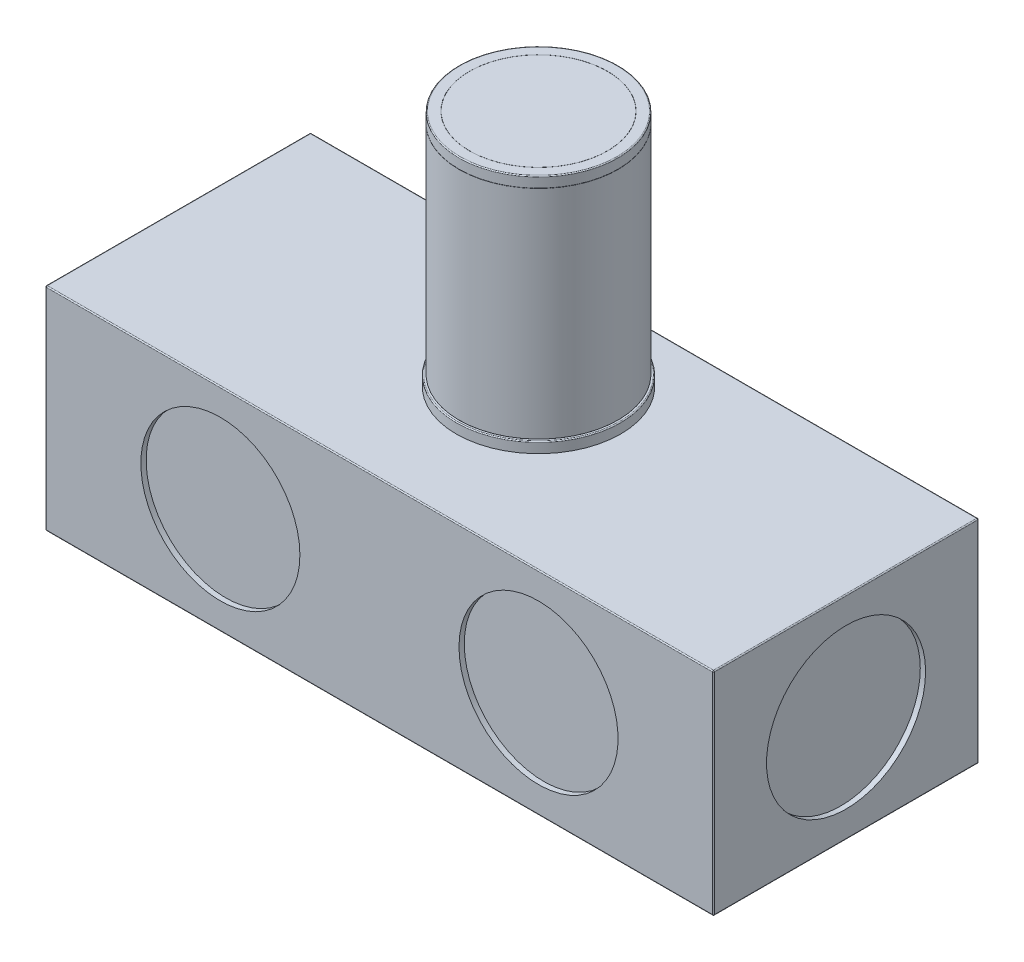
SolidWorks part; units mm, degrees
ref_plane "Front Plane" through (0, 0, 0) normal (0, 0, 1) x (1, 0, 0)
ref_plane "Top Plane" through (0, 0, 0) normal (0, 1, 0) x (1, 0, 0)
ref_plane "Right Plane" through (0, 0, 0) normal (1, 0, 0) x (0, 0, -1)
sketch "Sketch1" plane through (0, 0, 0) normal (0, 0, 1) x (1, 0, 0)
  line L1 (-31.5, 0) -> (31.5, 0)
  line L2 (-31.5, 0) -> (-31.5, 20)
  line L3 (-31.5, 20) -> (31.5, 20)
  line L4 (31.5, 0) -> (31.5, 20)
  dimension "D1" = 20
  dimension "D2" = 63
  dimension "D3" = 31.5
extrude "Boss-Extrude1" add sketch "Sketch1" along normal blind 25
sketch "Sketch2" plane through (31.5, 0, 0) normal (1, 0, 0) x (0, 0, -1)
  line L0 (-12.5, 20) -> (-12.5, 0) construction
  line L1 (-25, 20) -> (0, 20) construction
  line L2 (-25, 0) -> (0, 0) construction
  line L3 (0, 10) -> (-25, 10) construction
  line L4 (0, 0) -> (0, 20) construction
  line L5 (-25, 0) -> (-25, 20) construction
  circle A0 centre (-12.5, 10) radius 7.5
  dimension "D1" = 15
extrude "Cut-Extrude1" cut sketch "Sketch2" against normal blind 0.5
sketch "Sketch3" plane through (-31.5, 0, 0) normal (-1, 0, 0) x (0, 0, 1)
  line L0 (12.5, 20) -> (12.5, 0) construction
  line L1 (25, 20) -> (0, 20) construction
  line L2 (25, 0) -> (0, 0) construction
  line L3 (25, 10) -> (0, 10) construction
  line L4 (25, 20) -> (25, 0) construction
  line L5 (0, 20) -> (0, 0) construction
  circle A0 centre (12.5, 10) radius 7.5
  dimension "D1" = 15
extrude "Cut-Extrude2" cut sketch "Sketch3" against normal blind 0.5
sketch "Sketch4" plane through (0, 0, 0) normal (1, 0, 0) x (0, 0, -1)
  line L0 (-10, 42.5) -> (-10, -7.5) construction
  line L1 (-17.5, 21.019) -> (-17.5, 41.481)
  line L2 (-25, 0) -> (0, 0) construction
  line L3 (-17.41, 42.5) -> (-16.51, 42.5)
  line L4 (0, 0) -> (0, 20) construction
  line L5 (-17.75, -0.81) -> (-17.75, 20.91)
  line L6 (-17.66, -0.9) -> (-14.75, -0.9)
  line L7 (-25, 20) -> (0, 20) construction
  line L8 (-17.66, 21) -> (-17.4, 21)
  line L11 (-17.4, 21.01) -> (-17.491, 21.01)
  line L12 (-17.491, 41.49) -> (-17.49, 41.49)
  line L13 (-17.49, 41.49) -> (-17.49, 41.5)
  line L14 (-17.49, 41.5) -> (-17.491, 41.5)
  line L15 (-17.5, 41.509) -> (-17.5, 42.41)
  line L16 (-10, 42.5) -> (-10, -0.9)
  line L17 (-14.75, -0.9) -> (-14.75, -1)
  line L18 (-14.75, -1) -> (-10, -1)
  line L19 (-10, -0.9) -> (-10, -1)
  line L20 (-16.51, 42.5) -> (-16.51, 42.4)
  line L21 (-16.51, 42.4) -> (-16.5, 42.4)
  line L22 (-16.5, 42.4) -> (-16.5, 42.5)
  line L23 (-16.5, 42.5) -> (-10, 42.5)
  line L24 (-17.4, 21) -> (-17.4, 21.01)
  arc A0 (-17.75, 20.91) -> (-17.66, 21) centre (-17.66, 20.91) cw
  arc A1 (-17.75, -0.81) -> (-17.66, -0.9) centre (-17.66, -0.81) ccw
  arc A2 (-17.5, 42.41) -> (-17.41, 42.5) centre (-17.41, 42.41) cw
  arc A3 (-17.491, 41.49) -> (-17.5, 41.481) centre (-17.491, 41.481) ccw
  arc A4 (-17.491, 41.5) -> (-17.5, 41.509) centre (-17.491, 41.509) cw
  arc A5 (-17.491, 21.01) -> (-17.5, 21.019) centre (-17.491, 21.019) cw
  point P22 (-17.75, 21)
  point P25 (-17.75, -0.9)
  point P28 (-17.5, 42.5)
  point P34 (-17.5, 41.49)
  point P37 (-17.5, 41.5)
  dimension "D13" = 0.09
  dimension "D17" = 0.009
  dimension "D21" = 0.009
  dimension "D1" = 10
  dimension "D2" = 50
  dimension "D3" = 7.5
  dimension "D4" = 7.75
  dimension "D5" = 1
  dimension "D6" = 0.9
  dimension "D7" = 7.5
  dimension "D8" = 0.01
  dimension "D9" = 0.01
  dimension "D10" = 0.01
  dimension "D11" = 0.1
  dimension "D12" = 1
  dimension "D14" = 3
  dimension "D15" = 0.1
  dimension "D16" = 7.75
  dimension "D18" = 0.01
  dimension "D19" = 0.1
  dimension "D20" = 1
revolve "Revolve2" add sketch "Sketch4" angle 360 about L0
sketch "Sketch6" plane through (0, -1, 0) normal (0, -1, 0) x (1, 0, 0)
  line L1 (0, 17.7942) -> (-6.75, 13.8971)
  line L2 (-6.75, 13.8971) -> (-6.75, 6.1029)
  line L3 (-6.75, 6.1029) -> (0, 2.2058)
  line L4 (0, 2.2058) -> (6.75, 6.1029)
  line L5 (6.75, 6.1029) -> (6.75, 13.8971)
  line L6 (6.75, 13.8971) -> (0, 17.7942)
  circle A0 centre (0, 10) radius 6.75 construction
  dimension "D1" = 13.5
extrude "Boss-Extrude3" add sketch "Sketch6" along normal blind 6.5
sketch "Sketch7" plane through (0, 0, 0) normal (1, 0, 0) x (0, 0, -1)
  line L0 (-18.0242, -6.72) -> (-16.6384, -7.62)
  line L1 (-13.8971, -7.5) -> (-17.7942, -7.5) construction
  line L2 (-18.0242, -6.72) -> (-18.0242, -7.62)
  line L3 (-18.0242, -7.62) -> (-16.6384, -7.62)
  line L4 (-10, -1) -> (-10, -7.5) construction
  line L5 (-6.1029, -1) -> (-13.8971, -1) construction
  line L6 (-6.1029, -7.5) -> (-13.8971, -7.5) construction
  line L7 (-17.7942, -4.25) -> (-2.2058, -4.25) construction
  line L8 (-17.7942, -7.5) -> (-17.7942, -1) construction
  line L9 (-2.2058, -7.5) -> (-2.2058, -1) construction
  line L10 (-13.8971, -1) -> (-17.7942, -1) construction
  line L11 (-18.0242, -1.78) -> (-18.0242, -0.9241)
  line L12 (-18.0242, -1.78) -> (-16.7078, -0.9241)
  line L13 (-18.0242, -0.9241) -> (-16.7078, -0.9241)
  dimension "D1" = 33
  dimension "D2" = 0.9
  dimension "D3" = 3.25
  dimension "D4" = 0.12
  dimension "D5" = 0.0759
  dimension "D6" = 0.23
revolve "Cut-Revolve1" cut sketch "Sketch7" angle 360 about L4
fillet "Fillet2" radius 0.1 12 edges at (0, 20, 25) (31.5, 10, 25) (0, 0, 25) (-31.5, 10, 25) (0, 0, 0) (31.5, 10, 0) (0, 20, 0) (-31.5, 10, 0) (-31.5, 0, 12.5) (-31.5, 20, 12.5) (31.5, 0, 12.5) (31.5, 20, 12.5)
sketch "Sketch8" plane through (0, 0, 25) normal (0, 0, 1) x (1, 0, 0)
  line L0 (-31.4, 10) -> (31.4, 10) construction
  line L1 (-31.4, 19.9) -> (-31.4, 0.1) construction
  line L2 (31.4, 0.1) -> (31.4, 19.9) construction
  line L3 (0, 0) -> (0, 19.9) construction
  line L4 (31.4, 19.9) -> (-31.4, 19.9) construction
  circle A0 centre (-15, 10) radius 7.5
  circle A1 centre (15, 10) radius 7.5
  dimension "D1" = 15
  dimension "D2" = 15
extrude "Cut-Extrude3" cut sketch "Sketch8" against normal blind 0.5
